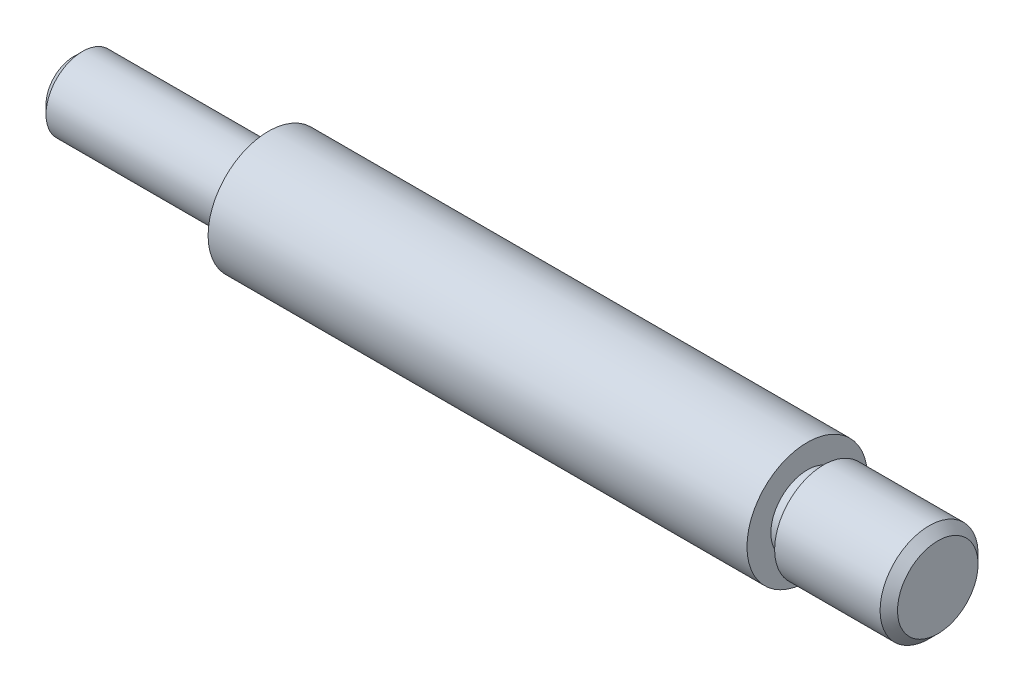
SolidWorks part; units mm, degrees
ref_plane "Plan de face" through (0, 0, 0) normal (0, 0, 1) x (1, 0, 0)
ref_plane "Plan de dessus" through (0, 0, 0) normal (0, 1, 0) x (1, 0, 0)
ref_plane "Plan de droite" through (0, 0, 0) normal (1, 0, 0) x (0, 0, -1)
sketch "Esquisse1" plane through (0, 0, 0) normal (0, 0, 1) x (1, 0, 0)
  line L0 (-94.4161, 25.3724) -> (-49.7357, 25.3724)
  line L1 (-49.7357, 25.3724) -> (-49.7357, 30.8505)
  line L2 (-49.7357, 30.8505) -> (73.9548, 30.8505)
  line L3 (73.9548, 30.8505) -> (73.9548, 25.3724)
  line L4 (73.9548, 25.3724) -> (77.703, 25.3724)
  line L5 (77.703, 25.3724) -> (77.703, 28.2556)
  line L6 (77.703, 28.2556) -> (103.9145, 28.2556)
  line L7 (103.9145, 17.011) -> (103.9145, 28.2556)
  line L9 (103.9145, 17.011) -> (-94.4161, 17.011)
  line L10 (-94.4161, 17.011) -> (-94.4161, 25.3724)
  line L11 (-85.776, 17.011) -> (110.5718, 17.011) construction
revolve "Révolution1" add sketch "Esquisse1" angle 360 about L11
chamfer "Chanfrein1" distance 2 angle 45 2 edges at (-94.4161, 17.011, 8.3614) (103.9145, 17.011, 11.2446)
